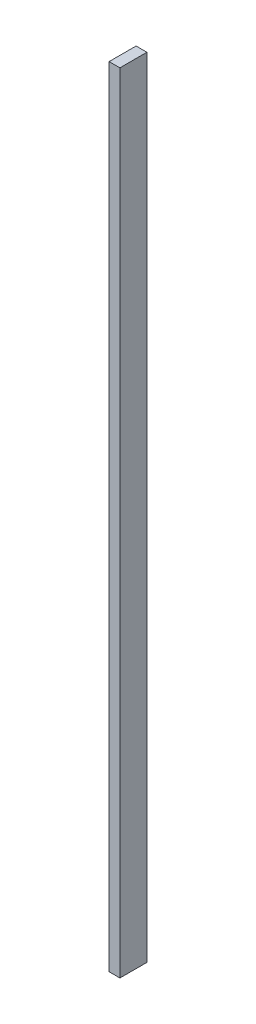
SolidWorks part; units mm, degrees
ref_plane "Plan de face" through (0, 0, 0) normal (0, 0, 1) x (1, 0, 0)
ref_plane "Plan de dessus" through (0, 0, 0) normal (0, 1, 0) x (1, 0, 0)
ref_plane "Plan de droite" through (0, 0, 0) normal (1, 0, 0) x (0, 0, -1)
sketch "Esquisse1" plane through (0, 0, 0) normal (0, 1, 0) x (1, 0, 0)
  line L1 (0, 0) -> (20, 0)
  line L2 (0, 0) -> (0, 50)
  line L3 (0, 50) -> (20, 50)
  line L4 (20, 0) -> (20, 50)
  dimension "D1" = 20
  dimension "D2" = 50
extrude "Extrusion1" add sketch "Esquisse1" along normal blind 1460
